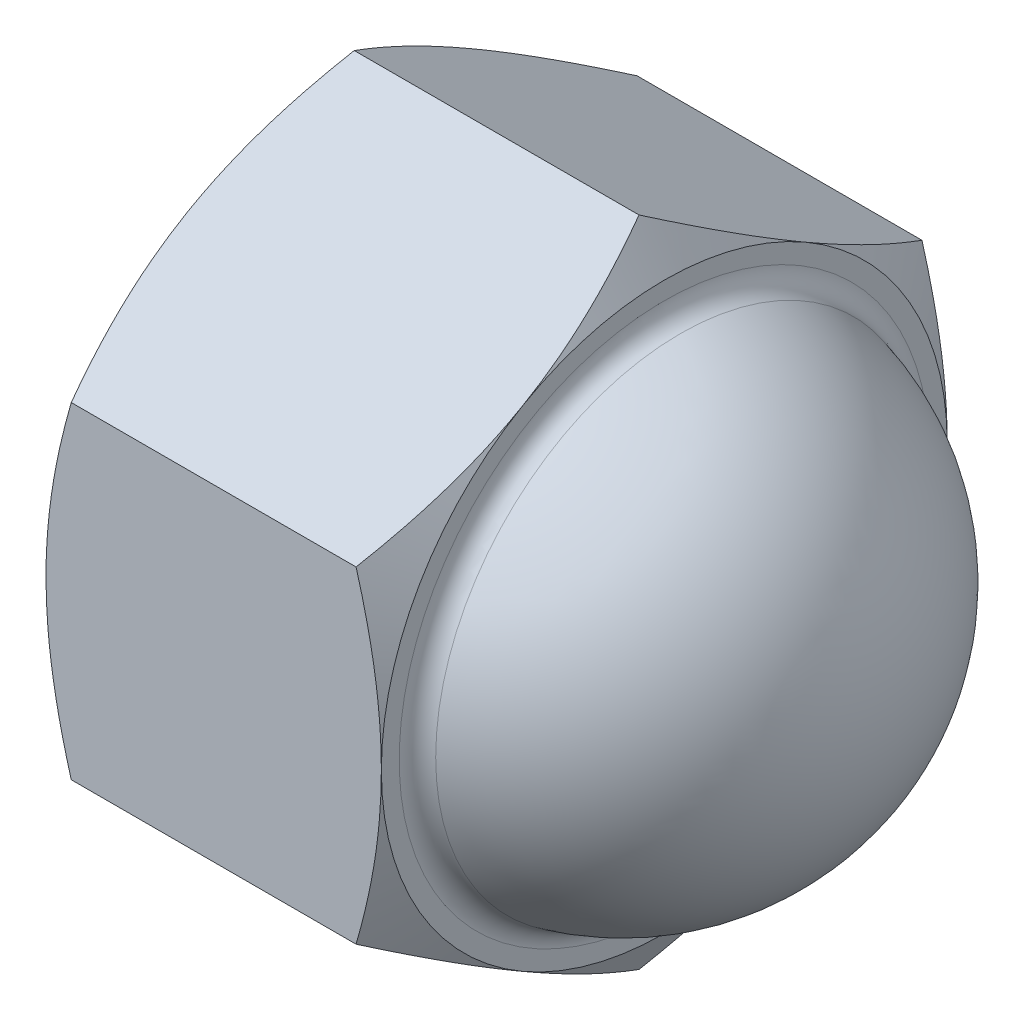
SolidWorks part; units mm, degrees
ref_plane "Plane1" through (0, 0, 0) normal (0, 0, 1) x (1, 0, 0)
ref_plane "Plane2" through (0, 0, 0) normal (0, 1, 0) x (1, 0, 0)
ref_plane "Plane3" through (0, 0, 0) normal (1, 0, 0) x (0, 0, -1)
sketch "BaseNutSke" plane through (0, 0, 0) normal (1, 0, 0) x (0, 0, -1)
  line L6 (13.5, 7.7942) -> (13.5, -7.7942)
  line L7 (-13.5, 7.7942) -> (-13.5, -7.7942)
  line L8 (13.5, 7.7942) -> (0, 15.5885)
  line L9 (0, 15.5885) -> (-13.5, 7.7942)
  line L10 (-13.5, -7.7942) -> (0, -15.5885)
  line L11 (0, -15.5885) -> (13.5, -7.7942)
  dimension "D4" = 60
  dimension "D1" = 120
  dimension "D2" = 13.5
  dimension "D3" = 13.5
  dimension "Width_flats" = 27
extrude "BaseNut" add sketch "BaseNutSke" along normal blind 16
sketch "DomeSke" plane through (0, 0, 0) normal (0, 0, 1) x (1, 0, 0)
  line L0 (0, 0) -> (63.5, 0) construction
  line L2 (26, 0) -> (24.4, 0)
  line L3 (0, 12) -> (14, 12)
  line L5 (0, 12) -> (0, 10.4)
  line L8 (0, 10.4) -> (14, 10.4)
  arc A0 (14, 12) -> (26, 0) centre (14, 0) cw
  arc A1 (14, 10.4) -> (24.4, 0) centre (14, 0) cw
  dimension "Dome_rad" = 12
  dimension "Overall_ht" = 26
  dimension "Dome_thk" = 1.6
revolve "Dome" add sketch "DomeSke" angle 360 about L0
sketch "Sketch4" plane through (0, 0, 0) normal (0, 0, 1) x (1, 0, 0)
  line L0 (0, 13.5) -> (2.5048, 17.8385)
  line L1 (16, 13.5) -> (13.4952, 17.8385)
  line L2 (2.5048, 17.8385) -> (13.4952, 17.8385)
  line L3 (16, 13.5) -> (18, 13.5)
  line L4 (18, 13.5) -> (18, 28.5)
  line L5 (18, 28.5) -> (-2, 28.5)
  line L6 (0, 13.5) -> (-2, 13.5)
  line L7 (-2, 13.5) -> (-2, 28.5)
  line L8 (16, 15.5885) -> (16, 7.7942) construction
  line L9 (0, 15.5885) -> (0, 7.7942) construction
  line L10 (0, 0) -> (57.15, 0) construction
  line L11 (16, 15.5885) -> (0, 15.5885) construction
  point P17 (16, 13.5)
  dimension "D1" = 30
  dimension "D2" = 30
  dimension "D3" = 2
  dimension "D4" = 2
  dimension "D5" = 2.25
  dimension "D6" = 15
  dimension "D7" = 13.5
revolve "DoubleChamfer" cut sketch "Sketch4" angle 360 about L10
sketch "TapDriSke" plane through (0, 0, 0) normal (0, 0, 1) x (1, 0, 0)
  line L0 (0, 0) -> (44.45, 0) construction
  line L1 (0, 8.75) -> (18.4, 8.75)
  line L2 (0, 0) -> (0, -11.6913) construction
  line L3 (18.4, 8.75) -> (23.6575, 0)
  line L4 (0, 0) -> (63.5, 0) construction
  line L5 (23.6575, 0) -> (0, 0)
  line L6 (0, 0) -> (0, 8.75)
  line L7 (18.4, -8.75) -> (23.6575, 0) construction
  line L8 (0, -8.75) -> (18.4, -8.75) construction
  line L9 (0.5, 6.35) -> (0.5, 3.175) construction
  dimension "TPA" = 118
  dimension "Thread_min" = 17.5
  dimension "Drill_depth" = 18.4
  dimension "Drill_clr" = 1
revolve "TapDrill" cut sketch "TapDriSke"
revolve "EndChamfer" cut sketch "EndChamferSketch" angle 360 about L4
sketch "EndChamferSketch" plane through (0, 0, 0) normal (0, 0, 1) x (1, 0, 0)
  line L0 (-0.0746, 10) -> (0.0254, 10)
  line L1 (0.0254, 10) -> (0.9882, 8.625)
  line L2 (0.9882, 8.625) -> (-0.0746, 8.625)
  line L3 (-0.0746, 8.625) -> (-0.0746, 10)
  line L4 (0, 0) -> (-15.875, 0) construction
  line L5 (15.9746, 10) -> (16.1, 10)
  line L6 (16.1, 10) -> (16.1, 8.625)
  line L7 (16.1, 8.625) -> (15.0118, 8.625)
  line L8 (15.0118, 8.625) -> (15.9746, 10)
  line L9 (16, -11.6913) -> (16, 0) construction
  dimension "D1" = 0.1
  dimension "D2" = 35
  dimension "D3" = 0.0254
  dimension "ChamferDepth" = 1.375
  dimension "ThreadMajor" = 10
  dimension "D4" = 35
  dimension "D5" = 0.1
  dimension "D6" = 0.0254
sketch "ThdSchSke" plane through (0, 0, 0) normal (0, 1, 0) x (1, 0, 0)
  line L0 (0.0381, 10) -> (-0.8372, 8.75)
  line L1 (-0.8372, 8.75) -> (-0.8372, 4.375)
  line L2 (-0.8372, 4.375) -> (0.9134, 4.375)
  line L3 (0.9134, 4.375) -> (0.9134, 8.75)
  line L4 (0.9134, 8.75) -> (0.0381, 10)
  line L5 (-38.1, 0) -> (3.175, 0) construction
  line L6 (0, 0) -> (-15.875, 0) construction
  line L7 (0, 0) -> (63.5, 0) construction
  line L9 (2.5381, 0.475) -> (2.5381, -5.875) construction
  dimension "D1" = 0.0381
  dimension "VeeAngle" = 70
  dimension "SideAngle" = 55
  dimension "Thread_major" = 20
  dimension "Tap_drill" = 17.5
  dimension "OverCut" = 8.75
  dimension "Advance" = 2.5
revolve "ThreadSchematic" [suppressed] cut sketch "ThdSchSke" angle 360 about L5
pattern_linear "ThdSchPat" [suppressed]
fillet "DomeFillet" radius 1 1 edges at (16, 0, -11.8322)
equation "' \"Width_flats@BaseNutSke\" = 27"
equation "' \"Hex_ht@BaseNut\" = 16"
equation "' \"Overall_ht@DomeSke\" = 26"
equation "' \"Dome_rad@DomeSke\" = 12"
equation "' \"Thread_min@TapDriSke\" = 17.5"
equation "' \"Drill_clr@TapDriSke\" = 1.0"
equation "' \"Advance@ThdSchSke\" = 2.5"
equation "' \"Thread_nominal@ThreadCosmetic\" = 20"
equation "' \"Radius@DomeFillet\" = 1.0"
equation "' \"Dome_thk@DomeSke\" = 1.6"
equation "\"Drill_depth@TapDriSke\" = \"Overall_ht@DomeSke\"  - \"Dome_thk@DomeSke\"- 0.3 * \"Thread_nominal@ThreadCosmetic\""
equation "\"Thread_depth@ThreadCosmetic\" = \"Thread_nominal@ThreadCosmetic\""
equation "\"D2@BaseNutSke\" = \"Width_flats@BaseNutSke\" / 2"
equation "\"D3@BaseNutSke\" = \"Width_flats@BaseNutSke\" / 2"
equation "\"D7@Sketch4\" = \"Width_flats@BaseNutSke\" / 2"
equation "\"D5@Sketch4\" = \"Width_flats@BaseNutSke\" / 12"
equation "\"Thread_major@ThdSchSke\" = \"Thread_nominal@ThreadCosmetic\""
equation "\"Tap_drill@ThdSchSke\" = \"Thread_min@TapDriSke\""
equation "\"Overcut@ThdSchSke\" = \"Tap_drill@ThdSchSke\" * 0.5"
equation "\"Num_threads@ThdSchPat\" = int(  ( \"Hex_ht@BaseNut\" - 0.002 ) / \"Advance@ThdSchSke\" + 0.999 )  + 1"
equation "' \"Num_threads@ThdSchPat\" = int(  ( \"Thread_depth@ThreadCosmetic\" - 0.002 ) / \"Advance@ThdSchSke\" + 0.999 )  + 1"
equation "\"Advance@ThdSchPat\" = ( \"Hex_ht@BaseNut\" - 0.002 ) /  (\"Num_threads@ThdSchPat\" - 1) 'relax it"
equation "' \"Advance@ThdSchPat\" = ( \"Thread_depth@ThreadCosmetic\" - 0.002 ) /  (\"Num_threads@ThdSchPat\" - 1) 'relax it"
equation "\"ThreadMajor@EndChamferSketch\" = \"Thread_nominal@ThreadCosmetic\" * 0.5"
equation "\"ChamferDepth@EndChamferSketch\" = (\"Thread_nominal@ThreadCosmetic\" - \"Thread_min@TapDriSke\") * 0.55"
